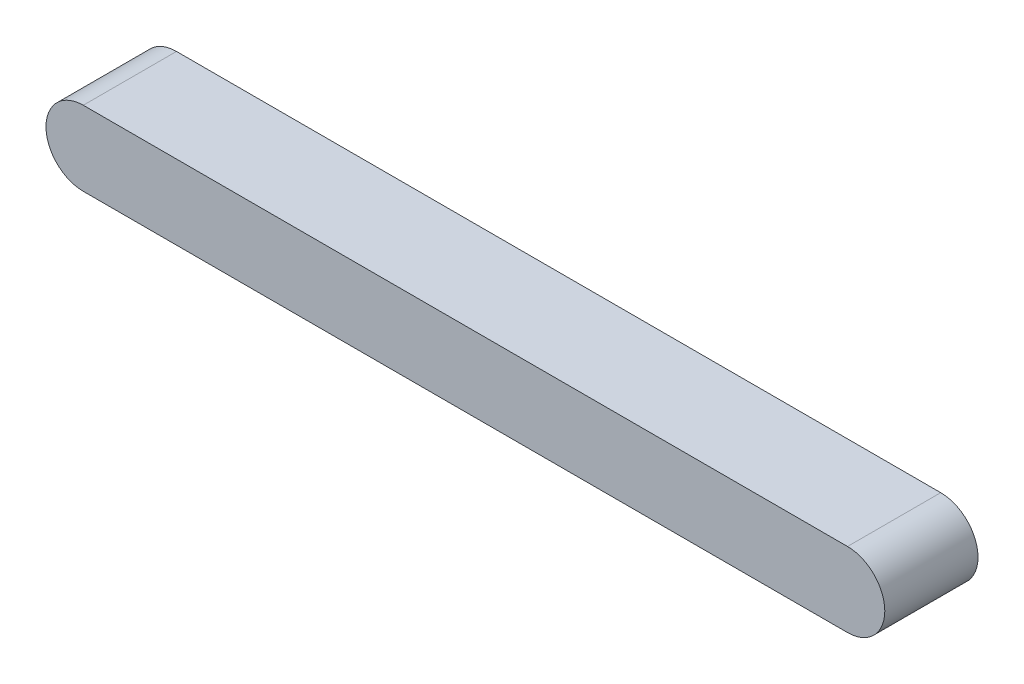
SolidWorks part; units mm, degrees
ref_plane "Ebene vorne" through (0, 0, 0) normal (0, 0, 1) x (1, 0, 0)
ref_plane "Ebene oben" through (0, 0, 0) normal (0, 1, 0) x (1, 0, 0)
ref_plane "Ebene rechts" through (0, 0, 0) normal (1, 0, 0) x (0, 0, -1)
sketch "Skizze1" plane through (0, 0, 0) normal (0, 0, 1) x (1, 0, 0)
  line L0 (-20.5, 0) -> (20.5, 0) construction
  line L1 (0, 0) -> (0, 28.0847) construction
  line L2 (-20.5, -2) -> (20.5, -2)
  line L3 (-20.5, 2) -> (20.5, 2)
  arc A0 (-20.5, -2) -> (-20.5, 2) centre (-20.5, 0) cw
  arc A1 (20.5, -2) -> (20.5, 2) centre (20.5, 0) ccw
  point P9 (7, 0)
  dimension "D1" = 41
  dimension "D4" = 7
  dimension "D2" = 2
  dimension "D3" = 2
extrude "Linear austragen1" add sketch "Skizze1" against normal blind 5
equation "\"LÄNGE\"=0"
equation "\"BREITE\"=0"
equation "\"HÖHE\"=0"
equation "\"DURCHMESSER\"=0"
equation "\"Stückzahl\"= 1"
